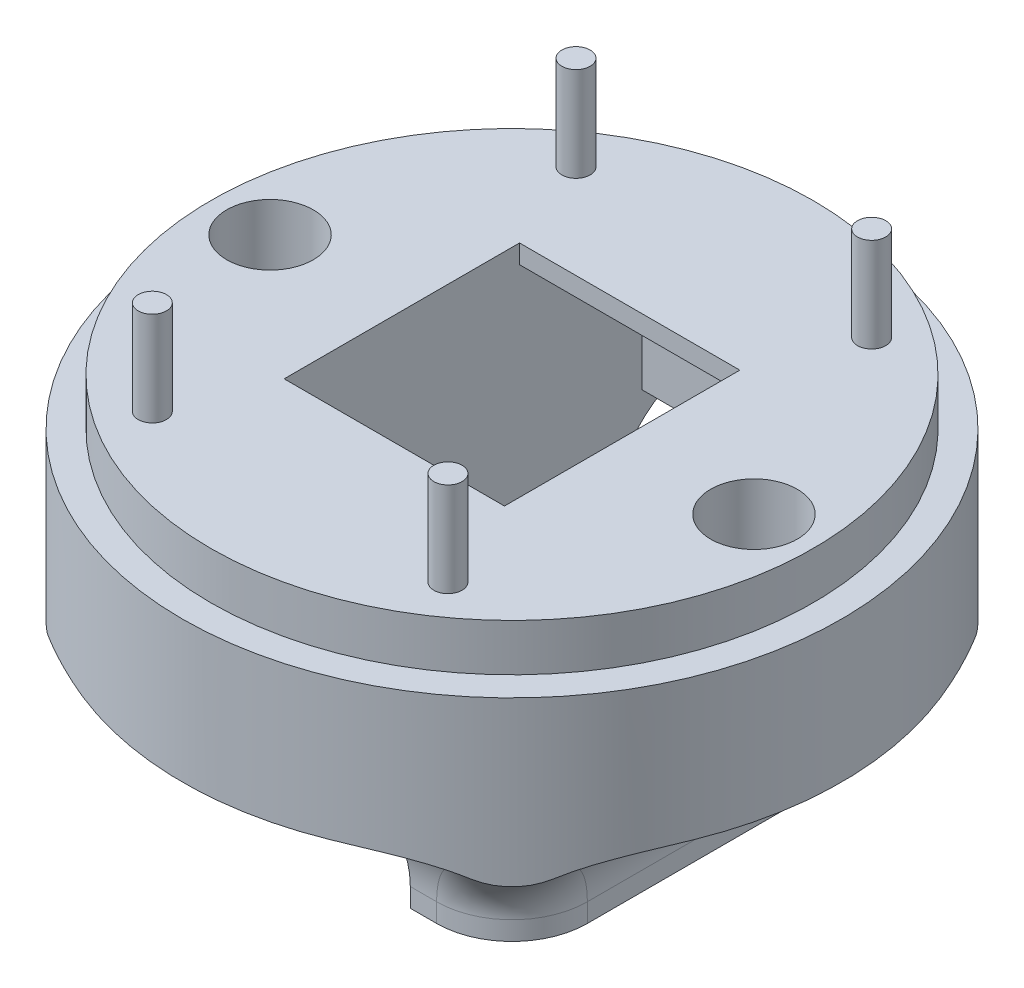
SolidWorks part; units mm, degrees
ref_plane "Plan de face" through (0, 0, 0) normal (0, 0, 1) x (1, 0, 0)
ref_plane "Plan de dessus" through (0, 0, 0) normal (0, 1, 0) x (1, 0, 0)
ref_plane "Plan de droite" through (0, 0, 0) normal (1, 0, 0) x (0, 0, -1)
sketch "Esquisse2" plane through (0, 0, 0) normal (0, 1, 0) x (1, 0, 0)
  circle A0 centre (0, 0) radius 35
  dimension "D1" = 70
extrude "Boss.-Extru.1" add sketch "Esquisse2" along normal blind 20
sketch "Esquisse3" plane through (0, 0, 0) normal (0, -1, 0) x (1, 0, 0)
  line L0 (0, 35) -> (0, -35) construction
  line L1 (-11.7, 22.5) -> (-11.7, -22.5)
  line L2 (11.7, 22.5) -> (11.7, -22.5)
  line L3 (11.7, 22.5) -> (22.5, 22.5)
  line L4 (22.5, -22.5) -> (11.7, -22.5)
  line L5 (-22.5, -22.5) -> (-11.7, -22.5)
  line L6 (-22.5, 22.5) -> (-22.5, -22.5)
  line L7 (-22.5, 22.5) -> (-11.7, 22.5)
  line L8 (22.5, -22.5) -> (22.5, 22.5)
  circle A0 centre (0, 0) radius 35 construction
  circle A1 centre (-17, 16.5) radius 3.1
  circle A2 centre (16.8, 16.5) radius 3.1
  circle A3 centre (16.8, -16.5) radius 3.1
  circle A4 centre (-17, -16.5) radius 3.1
  dimension "D5" = 6.2
  dimension "D2" = 6
  dimension "D3" = 22.5
  dimension "D4" = 22.5
  dimension "D8" = 45
  dimension "D9" = 5.5
  dimension "D10" = 10.8
  dimension "D11" = 10.8
  dimension "D12" = 45
  dimension "D6" = 2
  dimension "D7" = 2
extrude "Boss.-Extru.2" add sketch "Esquisse3" along normal blind 12
fillet "Congé3" radius 10 6 edges at (17.1, 0, -22.5) (-17.1, 0, -22.5) (-22.5, 0, 0) (22.5, 0, 0) (17.1, 0, 22.5) (-17.1, 0, 22.5)
fillet "Congé4" radius 8 8 edges at (23.0789, -6.6468, 23.0789) (-23.0789, -6.6468, 23.0789) (-23.0789, -6.6468, -23.0789) (23.0789, -6.6468, -23.0789) (22.5, -11, 22.5) (-22.5, -11, 22.5) (-22.5, -11, -22.5) (22.5, -11, -22.5)
sketch "Esquisse4" plane through (0, 0, 0) normal (0, -1, 0) x (1, 0, 0)
  line L0 (-11.7, -22.5) -> (-11.7, 22.5) construction
  line L1 (-11.7, 12.5) -> (11.7, 12.5)
  line L2 (-11.7, 12.5) -> (-11.7, -12.5)
  line L3 (-11.7, -12.5) -> (11.7, -12.5)
  line L4 (11.7, 12.5) -> (11.7, -12.5)
  line L5 (11.7, 22.5) -> (11.7, -22.5) construction
  line L6 (-11.7, 22.5) -> (-14.5, 22.5) construction
  line L7 (-14.5, -22.5) -> (-11.7, -22.5) construction
  dimension "D1" = 10
  dimension "D2" = 10
extrude "Enlèv. mat.-Extru.1" cut sketch "Esquisse4" against normal blind 21
sketch "Esquisse5" plane through (0, 20, 0) normal (0, 1, 0) x (1, 0, 0)
  line L4 (-11.7, 12.5) -> (-11.7, -12.5) construction
  line L5 (11.7, -12.5) -> (11.7, 12.5) construction
  line L6 (-11.7, -12.5) -> (11.7, -12.5) construction
  line L7 (11.7, 12.5) -> (-11.7, 12.5) construction
  circle A0 centre (-15.7, 22.5) radius 1.5
  circle A1 centre (-15.7, -22.5) radius 1.5
  circle A2 centre (15.7, 22.5) radius 1.5
  circle A3 centre (15.7, -22.5) radius 1.5
  dimension "D9" = 3
  dimension "D10" = 3
  dimension "D11" = 3
  dimension "D12" = 3
  dimension "D2" = 10
  dimension "D3" = 10
  dimension "D4" = 10
  dimension "D5" = 4
  dimension "D6" = 4
  dimension "D7" = 4
  dimension "D8" = 4
  dimension "D13" = 10
extrude "Boss.-Extru.3" add sketch "Esquisse5" along normal blind 10
sketch "Esquisse6" plane through (0, 20, 0) normal (0, 1, 0) x (1, 0, 0)
  circle A0 centre (0, 0) radius 32
  circle A1 centre (0, 0) radius 35 construction
  circle A2 centre (0, 0) radius 35
  dimension "D1" = 3
extrude "Enlèv. mat.-Extru.2" cut sketch "Esquisse6" against normal blind 5
sketch "Esquisse7" plane through (0, 20, 0) normal (0, 1, 0) x (1, 0, 0)
  line L0 (-11.7, 12.5) -> (-11.7, -12.5) construction
  line L1 (11.7, -12.5) -> (11.7, 12.5) construction
  line L3 (-11.7, -12.5) -> (11.7, -12.5) construction
  circle A0 centre (-25.7, 0) radius 4.6
  circle A1 centre (25.7, 0) radius 4.6
  dimension "D1" = 9.2
  dimension "D2" = 9.2
  dimension "D3" = 14
  dimension "D4" = 14
  dimension "D5" = 12.5
  dimension "D6" = 12.5
extrude "Enlèv. mat.-Extru.3" cut sketch "Esquisse7" against normal blind 10
sketch "Esquisse8" plane through (0, 0, 0) normal (0, -1, 0) x (1, 0, 0)
  line L0 (-11.7, 22.5) -> (-11.7, 32.5) construction
  line L1 (-11.7, 25.5) -> (11.7, 25.5)
  line L2 (-11.7, 25.5) -> (-11.7, -25.5)
  line L3 (-11.7, -25.5) -> (11.7, -25.5)
  line L4 (11.7, 25.5) -> (11.7, -25.5)
  line L5 (11.7, -12.5) -> (11.7, -32.5) construction
  line L8 (-11.7, 12.5) -> (11.7, 12.5) construction
  line L9 (11.7, -12.5) -> (-11.7, -12.5) construction
  dimension "D1" = 13
  dimension "D2" = 13
extrude "Enlèv. mat.-Extru.4" cut sketch "Esquisse8" against normal blind 18
